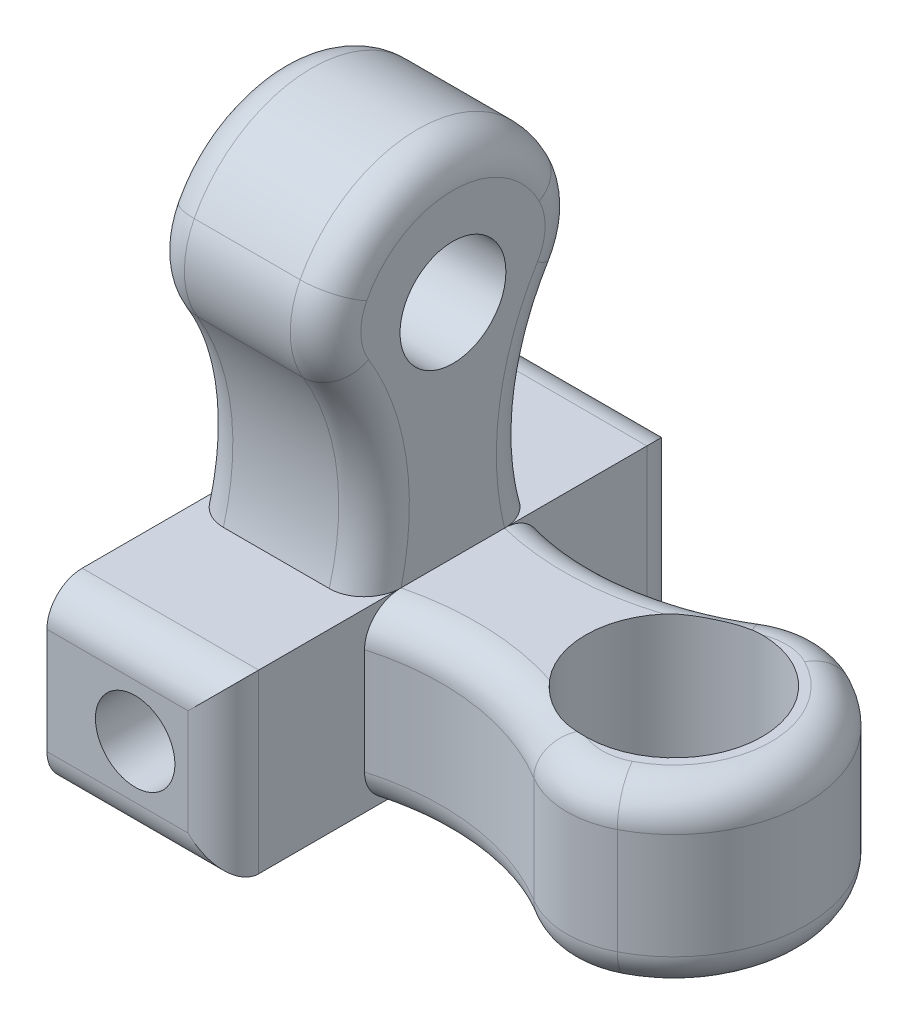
SolidWorks part; units mm, degrees
ref_plane "Front Plane" through (0, 0, 0) normal (0, 0, 1) x (1, 0, 0)
ref_plane "Top Plane" through (0, 0, 0) normal (0, 1, 0) x (1, 0, 0)
ref_plane "Right Plane" through (0, 0, 0) normal (1, 0, 0) x (0, 0, -1)
sketch "Sketch1" plane through (0, 0, 0) normal (0, 0, 1) x (1, 0, 0)
  line L0 (2.5, 13.0839) -> (1.103, 13.0839)
  line L2 (-2.5, 13.0839) -> (2.5, 13.0839)
  line L3 (-2.5, 13.0839) -> (-2.5, -2.5)
  line L4 (-2.5, -2.5) -> (2.5, -2.5)
  line L5 (2.5, 13.0839) -> (2.5, 2.5)
  line L6 (2.5, 2.5) -> (15.5477, 2.5)
  line L7 (-2.5, 2.5) -> (-2.5, -2.5)
  line L8 (-2.5, -2.5) -> (15.5477, -2.5)
  line L9 (15.5477, 2.5) -> (15.5477, -2.5)
  circle A1 centre (0, 0) radius 1.125
  dimension "D1" = 5
  dimension "D2" = 2.5
  dimension "D3" = 5
  dimension "D4" = 2.5
extrude "Boss-Extrude1" add sketch "Sketch1" along normal mid plane 13 contours L9 L6 L5 L0 L2 L3 L4 L8 A1
sketch "Sketch2" plane through (0, 0, 0) normal (1, 0, 0) x (0, 0, -1)
  line L0 (-6.5, 2.5) -> (6.5, 2.5) construction
  line L1 (-6.5, 2.5) -> (-2.5, 2.5)
  line L2 (2.5, 2.5) -> (6.5, 2.5)
  line L3 (6.5, 2.5) -> (6.5, 13.0839)
  line L4 (6.5, 13.0839) -> (-6.5, 13.0839)
  line L5 (-6.5, 13.0839) -> (-6.5, 2.5)
  circle A0 centre (0.0046, 8.7691) radius 1.5
  arc A1 (3.3336, 10.4955) -> (-3.3265, 10.4912) centre (0.0046, 8.7691) ccw
  arc A2 (3.251, 8.0467) -> (2.5, 2.5) centre (9.2337, 4.4125) ccw
  arc A3 (-3.244, 8.0479) -> (-2.5, 2.5) centre (-9.2312, 4.4211) cw
  arc A4 (-3.244, 8.0479) -> (-3.3265, 10.4912) centre (-1.1058, 9.3432) cw
  arc A5 (3.251, 8.0467) -> (3.3336, 10.4955) centre (1.1143, 9.3446) ccw
  point P5 (2.5, 2.5)
  point P6 (-2.5, 2.5)
  point P16 (-3.7454, 8.7691)
  point P19 (3.7546, 8.7691)
  dimension "D1" = 7.5
  dimension "D2" = 3
  dimension "D5" = 7
  dimension "D6" = 7
  dimension "D7" = 2.5
  dimension "D3" = 5
  dimension "D4" = 2.5
extrude "Cut-Extrude1" cut sketch "Sketch2" against normal mid plane 13
sketch "Sketch3" plane through (0, 0, 0) normal (0, 1, 0) x (1, 0, 0)
  line L0 (2.5, 6.5) -> (2.5, 2.5)
  line L1 (2.5, -2.5) -> (2.5, -6.5)
  line L2 (2.5, -6.5) -> (13.0839, -6.5)
  line L3 (13.0839, 6.5) -> (16.8565, 6.5)
  line L4 (13.0839, 6.5) -> (2.5, 6.5)
  line L5 (16.8565, 6.5) -> (16.8565, -6.5)
  line L6 (16.8565, -6.5) -> (13.0839, -6.5)
  circle A0 centre (8.7691, -0.0046) radius 2.5
  arc A1 (10.4955, -3.3336) -> (10.4912, 3.3265) centre (8.7691, -0.0046) ccw
  arc A2 (8.0467, -3.251) -> (2.5, -2.5) centre (4.4125, -9.2337) ccw
  arc A3 (8.0479, 3.244) -> (2.5, 2.5) centre (4.4211, 9.2312) cw
  arc A4 (8.0479, 3.244) -> (10.4912, 3.3265) centre (9.3432, 1.1058) cw
  arc A5 (8.0467, -3.251) -> (10.4955, -3.3336) centre (9.3446, -1.1143) ccw
  point P5 (2.5, -2.5)
  point P6 (2.5, 2.5)
  point P18 (13.0839, 6.5)
  point P19 (2.5, 2.5)
  dimension "D1" = 7.5
  dimension "D2" = 5
  dimension "D4" = 7
  dimension "D5" = 7
  dimension "D6" = 2.5
  dimension "D3" = 5
extrude "Cut-Extrude3" cut sketch "Sketch3" against normal mid plane 13
fillet "Fillet3" radius 1 6 edges at (0, 2.5, 6.5) (0, 2.5, -6.5) (0, -2.5, 6.5) (0, -2.5, -6.5) (2.5, 0, 6.5) (2.5, 0, -6.5)
fillet "Fillet4" radius 1 10 edges at (-2.5, 5.3515, 2.2933) (-2.5, 9.2588, 3.6043) (-2.5, 5.3517, -2.297) (-2.5, 9.2603, -3.6129) (2.5, 5.3515, 2.2933) (2.5, 9.2588, 3.6043) (2.5, 5.3517, -2.297) (2.5, 9.2603, -3.6129) (-2.5, 12.5191, -0.0022) (2.5, 12.5191, -0.0022)
fillet "Fillet5" radius 1 10 edges at (5.3515, -2.5, -2.2933) (9.2588, -2.5, -3.6043) (5.3517, -2.5, 2.297) (9.2603, -2.5, 3.6129) (5.3515, 2.5, -2.2933) (9.2588, 2.5, -3.6043) (5.3517, 2.5, 2.297) (9.2603, 2.5, 3.6129) (12.5191, -2.5, 0.0022) (12.5191, 2.5, 0.0022)
